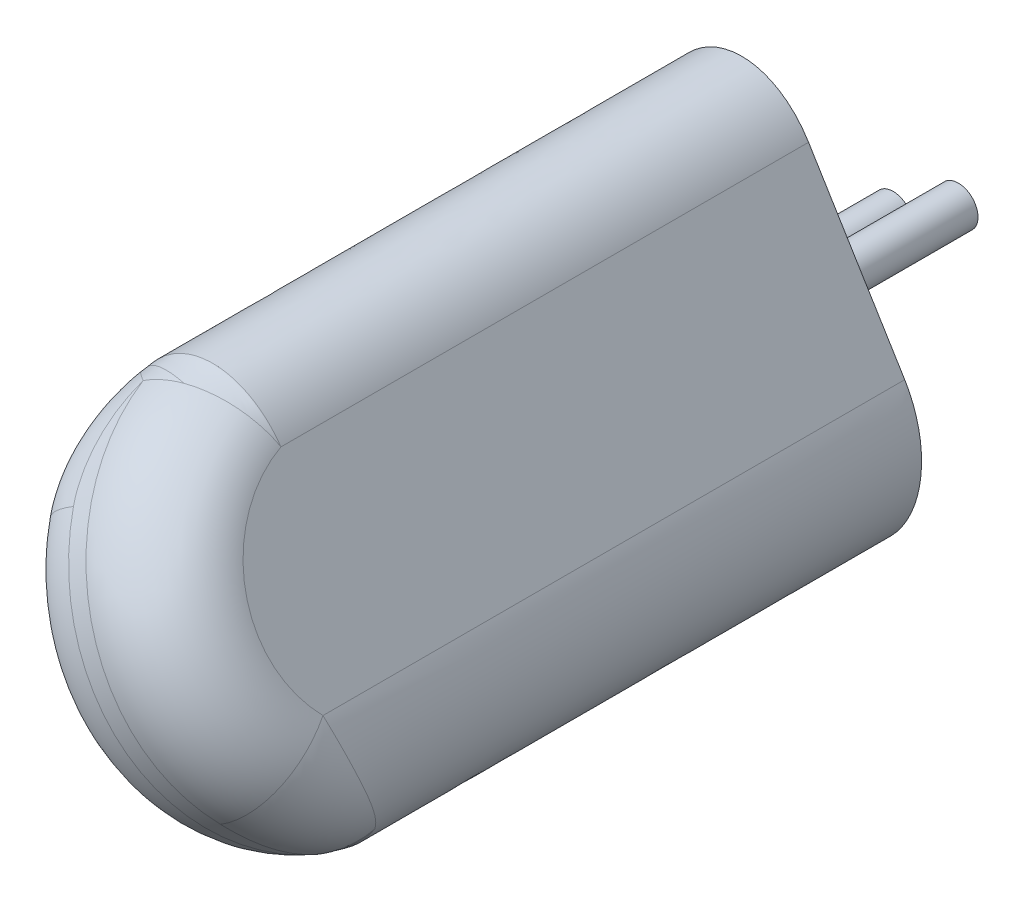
SolidWorks part; units mm, degrees
ref_plane "Front Plane" through (0, 0, 0) normal (0, 0, 1) x (1, 0, 0)
ref_plane "Top Plane" through (0, 0, 0) normal (0, 1, 0) x (1, 0, 0)
ref_plane "Right Plane" through (0, 0, 0) normal (1, 0, 0) x (0, 0, -1)
sketch "Sketch2" plane through (0, 0, 0) normal (0, 0, 1) x (1, 0, 0)
  line L0 (-2.9774, 22.3209) -> (6.7873, 6.3209)
  line L1 (-16.552, 9.6791) -> (-6.7873, -6.3209)
  ellipse E0 centre (-9.7647, 16) end of major axis (-9.7647, 22.0789) minor radius 4.9211
  ellipse E1 centre (0, 0) end of major axis (0, -6.0789) minor radius 4.9211
  ellipse E2 centre (-9.7647, 16) end of major axis (-9.7647, 26.5) minor radius 8.5 (-2.9774, 22.3209) -> (-16.552, 9.6791) ccw
  ellipse E3 centre (0, 0) end of major axis (0, -10.5) minor radius 8.5 (-6.7873, -6.3209) -> (6.7873, 6.3209) ccw
  dimension "D3" = 18.7443
extrude "Boss-Extrude1" add sketch "Sketch2" along normal blind 50
sketch "Sketch5" plane through (0, 0, 0) normal (0, 0, -1) x (-1, 0, 0)
  circle A0 centre (1.7681, 10.3393) radius 2
  circle A1 centre (8.3867, 6.2999) radius 2
  dimension "D3" = 4
  dimension "D4" = 4
sketch "Sketch7" plane through (0, 0, 50) normal (0, 0, 1) x (1, 0, 0)
  line L2 (6.7873, 6.3209) -> (-2.9774, 22.3209)
  line L3 (-16.552, 9.6791) -> (-6.7873, -6.3209)
  line L4 (6.7873, 6.3209) -> (-2.9774, 22.3209)
  line L5 (-16.552, 9.6791) -> (-6.7873, -6.3209)
  ellipse E2 centre (0, 0) end of major axis (0, -10.5) minor radius 8.5 (-6.7873, -6.3209) -> (6.7873, 6.3209) ccw
  ellipse E3 centre (-9.7647, 16) end of major axis (-9.7647, 26.5) minor radius 8.5 (-2.9774, 22.3209) -> (-16.552, 9.6791) ccw
  ellipse E4 centre (0, 0) end of major axis (0, -10.5) minor radius 8.5 (-6.7873, -6.3209) -> (6.7873, 6.3209) ccw
  ellipse E5 centre (-9.7647, 16) end of major axis (-9.7647, 26.5) minor radius 8.5 (-2.9774, 22.3209) -> (-16.552, 9.6791) ccw
  dimension "D1" = 0
extrude "Boss-Extrude4" add sketch "Sketch7" along normal blind 19.8413
sketch "Sketch8" plane through (7.7561, 4.7335, 0) normal (0.8536, 0.5209, 0) x (0, 0, -1)
  line L1 (-69.8413, 1.8597) -> (-69.8413, -9.9969) construction
  line L2 (-69.8413, -9.9969) -> (0, -9.9969) construction
  line L3 (-69.8413, 1.8597) -> (-69.8413, 20.604) construction
  line L4 (-69.8413, 28.7412) -> (-69.8413, 16.8847) construction
  line L5 (0, 28.7412) -> (-69.8413, 28.7412) construction
  line L6 (-69.8413, 1.8597) -> (-69.8413, -9.9969)
  line L7 (-69.8413, -9.9969) -> (-54.303, -9.9969)
  line L8 (-69.8413, 1.8597) -> (-69.8413, 20.604)
  line L9 (-69.8413, 28.7412) -> (-69.8413, 16.8847)
  line L10 (-54.303, 28.7412) -> (-69.8413, 28.7412)
  arc A0 (-54.303, 28.7412) -> (-54.303, -9.9969) centre (-50, 9.3722) ccw
extrude "Cut-Extrude2" cut sketch "Sketch8" against normal blind 19.8413 contours A0 L6 L7 M4 | A0 L10 L9 M2 | A0 L8 M2 M3 | A0 M3 M4
sketch "Sketch9" plane through (0, 0, 50) normal (0, 0, -1) x (-1, 0, 0)
  ellipse E1 centre (9.7647, 16) end of major axis (9.7647, 22.0789) minor radius 4.9211
  ellipse E2 centre (9.7647, 16) end of major axis (9.7647, 22.0789) minor radius 4.9211
  dimension "D1" = 0
sketch3d "3DSketch4"
  arc A0 (-9.7647, 16, 50) -> (0, 0, 50) centre (-4.8824, 8, 50) cw
  point P7 (3.1176, 12.8824, 50)
  dimension "D1" = 18.7443
sweep "Cut-Sweep1" cut profiles "Sketch9" path "3DSketch4" parameters "D1"=63
fillet "Fillet1" radius 8.05 2 edges at (-11.5375, 1.4626, 69.7284) (1.7728, 14.5374, 69.7284)
extrude "Boss-Extrude5" add sketch "Sketch5" along normal blind 14 contours A0 | A1
